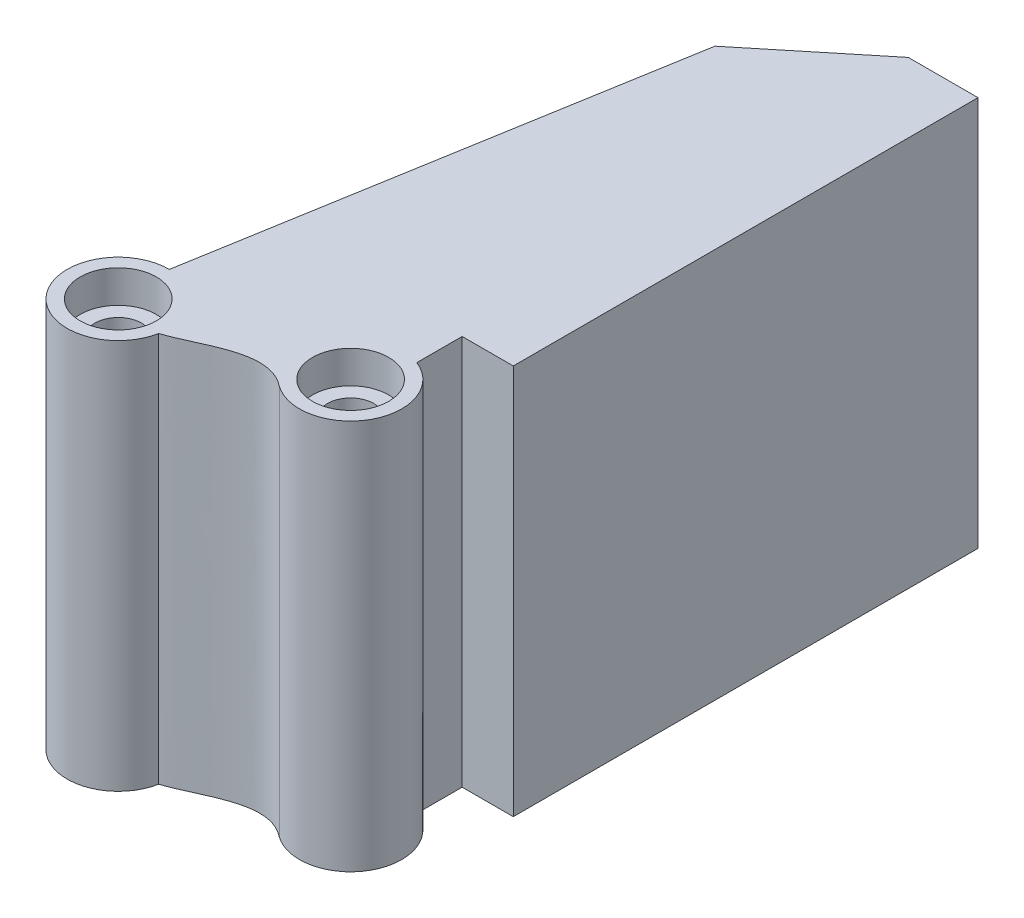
SolidWorks part; units mm, degrees
ref_plane "Front Plane" through (0, 0, 0) normal (0, 0, 1) x (1, 0, 0)
ref_plane "Top Plane" through (0, 0, 0) normal (0, 1, 0) x (1, 0, 0)
ref_plane "Right Plane" through (0, 0, 0) normal (1, 0, 0) x (0, 0, -1)
sketch "Sketch2" plane through (0, 0, 0) normal (0, 1, 0) x (1, 0, 0)
  line L0 (-0.029, -13.7042) -> (0.029, 11.2957)
  line L1 (-0.029, -13.7042) -> (-25, -12.5)
  line L2 (0.029, 11.2957) -> (25, 12.5)
  line L3 (0, -1.2043) -> (-11.6735, 37.0545)
  line L4 (-11.6735, 37.0545) -> (-32, 22.5)
  line L5 (-32, 22.5) -> (-52.2825, 31.6989)
  line L6 (-52.2825, 31.6989) -> (-27.5, 86.3416)
  line L7 (-12, 27.5) -> (-7.5, 91.3416)
  line L8 (-32, 22.5) -> (-27.5, 86.3416) construction
  line L9 (-7.5, 91.3416) -> (-27.5, 86.3416)
  line L10 (0, -108.7822) -> (0, 108.7822) construction
  line L11 (0, -1.2043) -> (11.6735, 37.0545)
  line L12 (32, 22.5) -> (27.5, 86.3416) construction
  line L13 (7.5, 91.3416) -> (27.5, 86.3416)
  line L14 (12, 27.5) -> (7.5, 91.3416)
  line L15 (52.2825, 31.6989) -> (27.5, 86.3416)
  line L16 (32, 22.5) -> (52.2825, 31.6989)
  line L17 (11.6735, 37.0545) -> (32, 22.5)
  line L18 (-25, -6.5) -> (-25, -46.5) construction
  line L19 (-15, -6.5) -> (-35, -6.5)
  line L20 (-15, -6.5) -> (-15, -46.5)
  line L21 (-15, -46.5) -> (-35, -46.5)
  line L22 (-35, -6.5) -> (-35, -46.5)
  line L24 (-7.5, 91.3416) -> (0, 91.3416)
  line L25 (-7.5, 91.3416) -> (-7.5, 151.3416)
  line L26 (-7.5, 151.3416) -> (0, 151.3416)
  line L27 (0, 91.3416) -> (0, 151.3416)
  line L28 (7.5, 91.3416) -> (0, 91.3416)
  line L29 (7.5, 91.3416) -> (7.5, 151.3416)
  line L30 (7.5, 151.3416) -> (0, 151.3416)
  line L31 (0, 91.3416) -> (0, 151.3416)
  circle A0 centre (25, 12.5) radius 1.5
  circle A1 centre (-25, -12.5) radius 1.5
  circle A2 centre (-12, 27.5) radius 1.5
  circle A3 centre (-32, 22.5) radius 1.5
  circle A4 centre (32, 22.5) radius 1.5
  circle A5 centre (12, 27.5) radius 1.5
  circle A6 centre (-25, -12.5) radius 10
  point P15 (0, -1.2043)
sketch "Sketch3" plane through (0, 0, 0) normal (0, 1, 0) x (1, 0, 0)
  line L0 (-7.5, 91.3416) -> (-7.5, 151.3416) construction
  line L1 (0, 151.3416) -> (-7.5, 151.3416)
  line L2 (0, 151.3416) -> (0, 101.3416)
  line L3 (0, 101.3416) -> (-7.5, 101.3416)
  line L4 (-7.5, 151.3416) -> (-7.5, 101.3416)
  line L5 (-7.5, 101.3416) -> (-7.5, 96.8416) construction
  line L6 (-5.5, 101.3416) -> (-5.5, 96.4651)
  line L7 (-7.5, 151.3416) -> (-18.9496, 141.9853)
  line L8 (-18.9496, 141.9853) -> (-27.5, 91.8416)
  circle A0 centre (-7.5, 91.3416) radius 2.5
  circle A1 centre (-27.5, 86.3416) radius 2.5
  circle A2 centre (-27.5, 86.3416) radius 4
  circle A3 centre (-7.5, 91.3416) radius 4
  circle A4 centre (-27.5, 86.3416) radius 5.5
  circle A5 centre (-7.5, 91.3416) radius 5.5
  spline S0 degree 3 poles (-10.7139, 86.8783) (-14.3726, 89.7782) (-18.7035, 86.3817) (-22.1021, 85.2869) knots 0 0 0 0 1 1 1 1
  dimension "D1" = 5
  dimension "D2" = 8
  dimension "D3" = 11
  dimension "D4" = 7.5
  dimension "D5" = 50
  dimension "D6" = 2
extrude "Boss-Extrude1" add sketch "Sketch3" along normal mid plane 42
sketch "Sketch4" plane through (0, 21, 0) normal (0, 1, 0) x (1, 0, 0)
  circle A0 centre (-27.5, 86.3416) radius 4.1
  circle A1 centre (-7.5, 91.3416) radius 4.1
  dimension "D1" = 8.2
  dimension "D2" = 8.2
extrude "Cut-Extrude1" cut sketch "Sketch4" against normal blind 3.5
sketch "Sketch5" plane through (0, -21, 0) normal (0, -1, 0) x (1, 0, 0)
  circle A0 centre (-27.5, -86.3416) radius 4.1
  circle A1 centre (-7.5, -91.3416) radius 4.1
  dimension "D1" = 8.2
extrude "Cut-Extrude2" cut sketch "Sketch5" against normal blind 3.5
equation "\"a\"= \"b\" / 2"
equation "\"b\"= 25"
equation "\"D1@Sketch2\"=2*\"a\""
equation "\"D2@Sketch2\"=\"b\""
equation "\"D5@Sketch2\"=\"a\""
equation "\"D4@Sketch2\"=\"a\""
equation "\"D6@Sketch2\"=\"b\""
equation "\"D7@Sketch2\"=\"b\""
equation "\"c\"= 64"
equation "\"D13@Sketch2\"=\"c\""
equation "\"D12@Sketch2\"=\"c\"-4"
